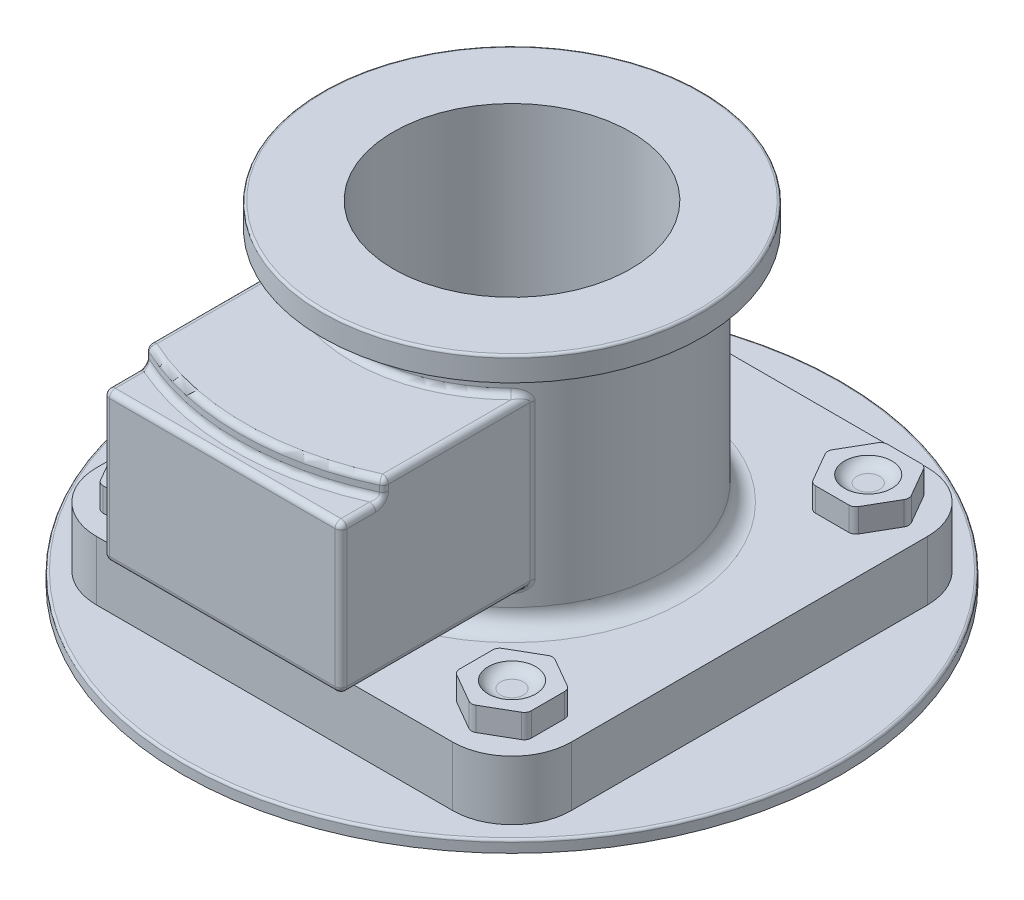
SolidWorks part; units mm, degrees
ref_plane "Front Plane" through (0, 0, 0) normal (0, 0, 1) x (1, 0, 0)
ref_plane "Top Plane" through (0, 0, 0) normal (0, 1, 0) x (1, 0, 0)
ref_plane "Right Plane" through (0, 0, 0) normal (1, 0, 0) x (0, 0, -1)
sketch "Sketch1" plane through (0, 0, 0) normal (0, 1, 0) x (1, 0, 0)
  circle A0 centre (0, 0) radius 277.5
  dimension "D1" = 555
extrude "Boss-Extrude1" add sketch "Sketch1" along normal blind 10
sketch "Sketch2" plane through (0, 10, 0) normal (0, 1, 0) x (1, 0, 0)
  line L1 (-200, -200) -> (200, -200)
  line L2 (-200, -200) -> (-200, 200)
  line L3 (-200, 200) -> (200, 200)
  line L4 (200, -200) -> (200, 200)
  line L5 (-200, -200) -> (200, 200) construction
  line L6 (-200, 200) -> (200, -200) construction
  point P0 (0, 0)
  dimension "D1" = 400
  dimension "D2" = 400
extrude "Boss-Extrude2" add sketch "Sketch2" along normal blind 50
fillet "Fillet1" radius 50 4 edges at (200, 35, -200) (-200, 35, -200) (-200, 35, 200) (200, 35, 200)
sketch "Sketch3" plane through (0, 60, 0) normal (0, 1, 0) x (1, 0, 0)
  circle A0 centre (0, 0) radius 130
  dimension "D1" = 260
extrude "Boss-Extrude3" add sketch "Sketch3" along normal blind 200
sketch "Sketch4" plane through (0, 260, 0) normal (0, 1, 0) x (1, 0, 0)
  circle A0 centre (0, 0) radius 160
  dimension "D1" = 320
extrude "Boss-Extrude4" add sketch "Sketch4" along normal blind 20
sketch "Sketch5" plane through (0, 0, 0) normal (0, 0, 1) x (1, 0, 0)
  line L0 (0, 338.3554) -> (0, -64.4039) construction
  line L1 (-150, 60) -> (150, 60) construction
  line L2 (-100, 90) -> (100, 90)
  line L3 (-100, 90) -> (-100, 230)
  line L4 (-100, 230) -> (100, 230)
  line L5 (100, 90) -> (100, 230)
  line L6 (-100, 90) -> (100, 230) construction
  line L7 (-100, 230) -> (100, 90) construction
  point P3 (0, 160)
  dimension "D1" = 140
  dimension "D2" = 200
  dimension "D3" = 30
extrude "Boss-Extrude5" add sketch "Sketch5" along normal blind 244
sketch "Sketch6" plane through (0, 230, 0) normal (0, 1, 0) x (1, 0, 0)
  line L3 (100, -244) -> (100, -83.0662)
  line L4 (-100, -83.0662) -> (-100, -244)
  line L5 (-100, -244) -> (100, -244)
  line L6 (100, -244) -> (100, -207.1232)
  line L7 (-100, -207.1232) -> (-100, -244)
  line L8 (-100, -244) -> (100, -244)
  arc A0 (-100, -207.1232) -> (100, -207.1232) centre (0, 0) ccw
  arc A2 (-100, -83.0662) -> (100, -83.0662) centre (0, 0) ccw
  dimension "D1" = 460
  dimension "D2" = 0
extrude "Cut-Extrude1" cut sketch "Sketch6" against normal blind 15
sketch "Sketch7" plane through (0, 280, 0) normal (0, 1, 0) x (1, 0, 0)
  circle A0 centre (0, 0) radius 100
  dimension "D1" = 200
extrude "Cut-Extrude2" cut sketch "Sketch7" against normal blind 200
fillet "Fillet2" radius 5 18 edges at (0, 215, 230) (0, 90, 130) (-100, 90, 163.5331) (-100, 160, 83.0662) (-100, 222.5, 207.1232) (-100, 215, 225.5616) (0, 90, 244) (-100, 152.5, 244) (0, 215, 244) (100, 160, 83.0662) (100, 90, 163.5331) (100, 152.5, 244) (100, 215, 225.5616) (100, 222.5, 207.1232) (0, 230, 130) (100, 230, 145.0947) (0, 230, 230) (-100, 230, 145.0947)
fillet "Fillet3" radius 15 1 edges at (0, 60, 130)
fillet "Fillet4" radius 2 2 edges at (0, 10, 277.5) (0, 280, 160)
sketch "Sketch8" plane through (0, 60, 0) normal (0, 1, 0) x (1, 0, 0)
  line L0 (-150, -200) -> (150, -200) construction
  line L1 (180.3109, -167.5) -> (180.3109, -132.5)
  line L2 (180.3109, -132.5) -> (150, -115)
  line L3 (150, -115) -> (119.6891, -132.5)
  line L4 (119.6891, -132.5) -> (119.6891, -167.5)
  line L5 (119.6891, -167.5) -> (150, -185)
  line L6 (150, -185) -> (180.3109, -167.5)
  line L7 (200, -150) -> (200, 150) construction
  circle A0 centre (150, -150) radius 30.3109 construction
  dimension "D1" = 35
  dimension "D2" = 50
  dimension "D3" = 50
extrude "Boss-Extrude6" add sketch "Sketch8" along normal blind 20
sketch "Sketch9" plane through (0, 80, 0) normal (0, 1, 0) x (1, 0, 0)
  circle A0 centre (150, -150) radius 20
  dimension "D1" = 40
extrude "Cut-Extrude3" cut sketch "Sketch9" against normal blind 6
fillet "Fillet5" radius 12 1 edges at (150, 74, 170)
fillet "Fillet6" radius 6 6 edges at (119.6891, 70, 132.5) (119.6891, 70, 167.5) (150, 70, 115) (180.3109, 70, 132.5) (150, 70, 185) (180.3109, 70, 167.5)
pattern_circular "CirPattern1" count 4 every 90 about axis through (0, 0, 0) along (0, 1, 0) of "Boss-Extrude6", "Cut-Extrude3", "Fillet5", "Fillet6"
